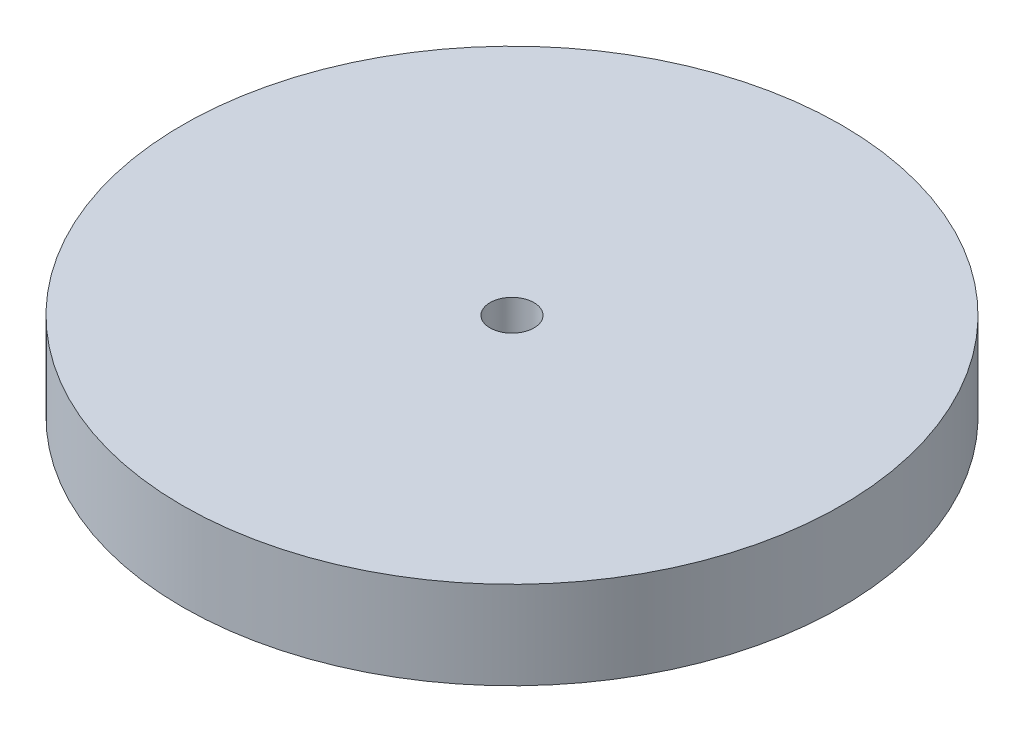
SolidWorks part; units mm, degrees
ref_plane "Plan de face" through (0, 0, 0) normal (0, 0, 1) x (1, 0, 0)
ref_plane "Plan de dessus" through (0, 0, 0) normal (0, 1, 0) x (1, 0, 0)
ref_plane "Plan de droite" through (0, 0, 0) normal (1, 0, 0) x (0, 0, -1)
sketch "Esquisse1" plane through (0, 0, 0) normal (0, 0, 1) x (1, 0, 0)
  line L0 (0, 0) -> (0, 21.7878) construction
  line L1 (-5, 0) -> (-75, 0)
  line L2 (-5, 0) -> (-5, 20)
  line L3 (-5, 20) -> (-75, 20)
  line L4 (-75, 0) -> (-75, 20)
  dimension "D1" = 10
  dimension "D2" = 150
  dimension "D3" = 20
revolve "Révolution1" add sketch "Esquisse1" angle 360 about L0
